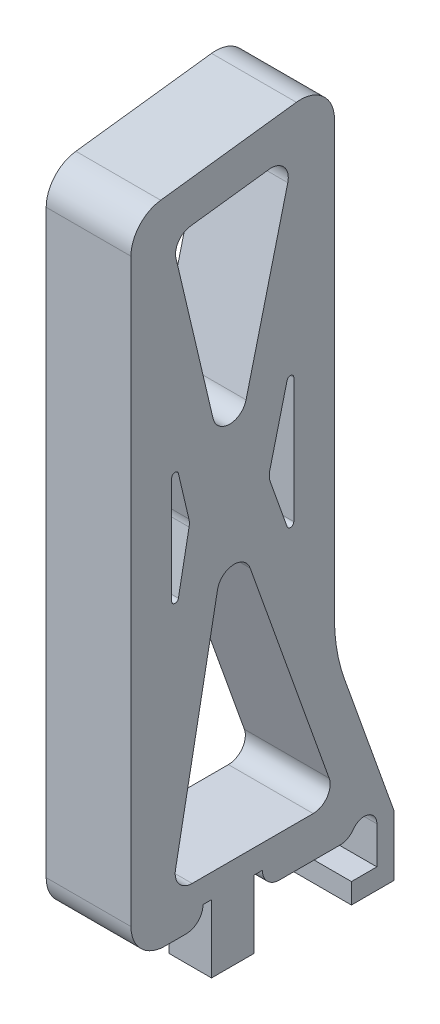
SolidWorks part; units mm, degrees
ref_plane "Alzado" through (0, 0, 0) normal (0, 0, 1) x (1, 0, 0)
ref_plane "Planta" through (0, 0, 0) normal (0, 1, 0) x (1, 0, 0)
ref_plane "Vista lateral" through (0, 0, 0) normal (1, 0, 0) x (0, 0, -1)
sketch "Croquis1" plane through (0, 0, 0) normal (1, 0, 0) x (0, 0, -1)
  line L0 (-12, 37.9989) -> (0, 39.5)
  line L1 (0, 39.5) -> (0, 0)
  line L2 (55, 0) -> (-55, 0) construction
  line L4 (-12, 0) -> (-12, 37.9989)
  line L8 (0, 0) -> (-12, 0)
  dimension "D1" = 12
  dimension "D2" = 7.13
  dimension "D3" = 39.5
extrude "Saliente-Extruir1" add sketch "Croquis1" along normal blind 5
sketch "Croquis3" plane through (0, 0, 0) normal (0, -1, 0) x (1, 0, 0)
  line L0 (2.75, 0) -> (-2.75, 0) construction
  line L2 (5, 12) -> (5, 0) construction
  line L3 (2.5, 4.75) -> (5, 4.75)
  line L4 (2.5, 4.75) -> (2.5, 7.25)
  line L5 (2.5, 7.25) -> (5, 7.25)
  line L6 (5, 4.75) -> (5, 7.25)
  line L7 (2.5, 4.75) -> (5, 7.25) construction
  line L8 (2.5, 7.25) -> (5, 4.75) construction
  point P8 (3.75, 6)
  dimension "D2" = 6
  dimension "D1" = 2.5
extrude "Saliente-Extruir2" add sketch "Croquis3" along normal blind 3
sketch "Croquis4" plane through (0, 0, 0) normal (1, 0, 0) x (0, 0, -1)
  line L0 (0, 0) -> (2.5, 0)
  line L1 (55, 0) -> (-55, 0) construction
  line L2 (2.5, 0) -> (2.5, -2.2)
  line L3 (2.5, -2.2) -> (3.5, -2.2)
  line L4 (3.5, 0.1916) -> (0, 10)
  line L5 (0, 55) -> (0, -55) construction
  line L6 (3.5, -2.2) -> (3.5, 0.1916)
  line L7 (0, 10) -> (0, 0)
  dimension "D1" = 1
  dimension "D2" = 2.5
  dimension "D3" = 10
  dimension "D4" = 2.2
extrude "Saliente-Extruir3" add sketch "Croquis4" along normal up to surface (5 mm away)
sketch "Croquis6" plane through (5, 0, 0) normal (1, 0, 0) x (0, 0, -1)
  line L5 (3.5, -2.2) -> (3.5, -3.4)
  line L6 (3.5, -3.4) -> (1, -3.4)
  line L7 (1, -3.4) -> (1, -2.2)
  line L8 (1, -2.2) -> (2.5, -2.2)
  line L9 (2.5, -2.2) -> (3.5, -2.2)
  dimension "D1" = 1.2
  dimension "D2" = 1.5
extrude "Saliente-Extruir4" add sketch "Croquis6" against normal up to surface (5 mm away)
fillet "Redondeo1" radius 10 1 edges at (2.5, 10, 0)
sketch "Croquis7" plane through (5, 0, 0) normal (1, 0, 0) x (0, 0, -1)
  line L18 (-9.6, 2.4) -> (0.1637, 2.4)
  line L19 (0.1637, 2.4) -> (-6.2114, 20.2657)
  line L20 (-6.2114, 20.2657) -> (-9.6, 2.4)
  line L21 (-9.6, 35.8804) -> (-2.4, 36.7811)
  line L22 (-2.4, 36.7811) -> (-6.2114, 21.5076)
  line L23 (-6.2114, 21.5076) -> (-9.6, 35.8804)
  line L24 (0, 39.5) -> (-12, 37.9989) construction
  line L25 (2.75, 0) -> (-2.75, 0) construction
  line L26 (3.5, 0.1916) -> (0.5817, 8.3699) construction
  line L27 (-12, 37.9989) -> (-12, 0) construction
  line L28 (0, 2.75) -> (0, -2.75) construction
  line L29 (-9.6, 15.279) -> (-8.5339, 20.8998)
  line L30 (-8.5339, 20.8998) -> (-9.6, 25.4218)
  line L31 (-9.6, 25.4218) -> (-9.6, 15.279)
  line L32 (-2.4, 26.8686) -> (-3.8894, 20.8998)
  line L33 (-3.8894, 20.8998) -> (-2.4, 16.7258)
  line L34 (-2.4, 16.7258) -> (-2.4, 26.8686)
  point P8 (-2.4, 29.497)
  point P9 (0, 0)
  point P12 (-9.6, 13.2598)
  point P15 (-6, 38.7495)
  point P18 (0, 0)
  dimension "D1" = 2.4
  dimension "D2" = 2.4
  dimension "D3" = 2.4
  dimension "D4" = 2.4
  dimension "D5" = 2.4
  dimension "D6" = 2.4
  dimension "D7" = 2.4
  dimension "D8" = 2.4
  dimension "D9" = 2.4
  dimension "D10" = 2.4
  dimension "D11" = 2.4
  dimension "D12" = 2.4
extrude "Cortar-Extruir2" cut sketch "Croquis7" against normal through all
fillet "Redondeo2" radius 1 8 edges at (2.5, 35.8804, 9.6) (2.5, 36.7811, 2.4) (2.5, 21.5076, 6.2114) (2.5, 2.4, 9.6) (2.5, 2.4, -0.1637) (2.5, 20.2657, 6.2114) (2.5, 20.8998, 3.8894) (2.5, 20.8998, 8.5339)
fillet "Redondeo7" radius 0.2 4 edges at (2.5, 26.8686, 2.4) (2.5, 16.7258, 2.4) (2.5, 15.279, 9.6) (2.5, 25.4218, 9.6)
fillet "Redondeo3" radius 2 2 edges at (2.5, 37.9989, 12) (2.5, 39.5, 0)
fillet "Redondeo4" radius 2 1 edges at (2.5, 0, 12)
sketch "Croquis9" plane through (0, 0, 0) normal (0, -1, 0) x (1, 0, 0)
  line L0 (5.5, 7.75) -> (2, 7.75)
  line L1 (2, 7.75) -> (2, 4.25)
  line L2 (2, 4.25) -> (5.5, 4.25)
  line L3 (5.5, 4.25) -> (5.5, 7.75)
  line L4 (5, 4.75) -> (5, 7.25)
  line L5 (5, 7.25) -> (2.5, 7.25)
  line L6 (2.5, 7.25) -> (2.5, 4.75)
  line L7 (2.5, 4.75) -> (5, 4.75)
  line L8 (5, 4.75) -> (5, 7.25)
  line L9 (5, 7.25) -> (2.5, 7.25)
  line L10 (2.5, 7.25) -> (2.5, 4.75)
  line L11 (2.5, 4.75) -> (5, 4.75)
  dimension "D1" = 0
  dimension "D2" = 0.5
extrude "Cortar-Extruir3" cut sketch "Croquis9" against normal blind 1
sketch "Croquis10" plane through (5, 0, 0) normal (1, 0, 0) x (0, 0, -1)
  line L0 (2.75, 0) -> (-2.75, 0) construction
  line L1 (2.5, 0) -> (2.5, -2.2) construction
  circle A0 centre (1.75, 0) radius 0.75
  dimension "D1" = 1.5
extrude "Cortar-Extruir4" cut sketch "Croquis10" against normal through all
fillet "Redondeo5" radius 1 1 edges at (2.5, 0, -1)
fillet "Redondeo6" radius 1 2 edges at (3.5, 0, 7.75) (3.5, 0, 4.25)
